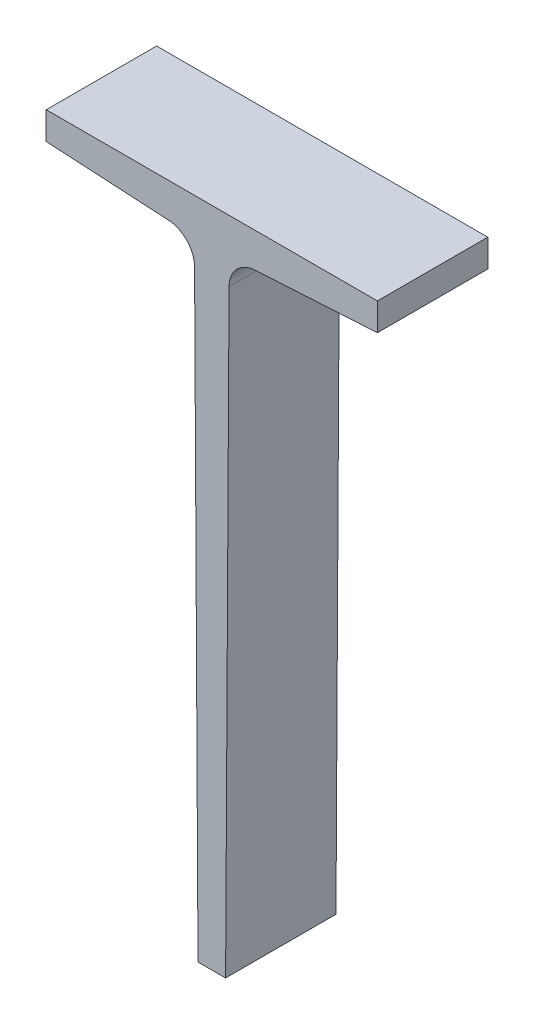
SolidWorks part; units mm, degrees
ref_plane "Plane1" through (0, 0, 0) normal (0, 0, 1) x (1, 0, 0)
ref_plane "Plane2" through (0, 0, 0) normal (0, 1, 0) x (-1, 0, 0)
ref_plane "Plane3" through (0, 0, 0) normal (1, 0, 0) x (0, 0, -1)
other "Configuration Table"
sketch "Sketch1" plane through (0, 0, 0) normal (0, 0, 1) x (1, 0, 0)
  line L0 (0, 0) -> (76.2, 0)
  line L1 (15.6984, 0) -> (-15.6984, 0) construction
  line L2 (34.925, -152.4) -> (34.1313, -14.2409)
  line L3 (28.139, -7.9375) -> (0, -6.35)
  line L4 (0, -9.8115) -> (0, 9.8115) construction
  line L5 (76.2, 0) -> (76.2, -6.35)
  line L6 (0, 0) -> (0, -6.35)
  line L7 (76.2, -6.35) -> (48.061, -7.9375)
  line L8 (42.0688, -14.2409) -> (41.275, -152.4)
  line L9 (34.925, -152.4) -> (41.275, -152.4)
  arc A1 (34.1313, -14.2409) -> (28.139, -7.9375) centre (27.7814, -14.2774) ccw
  arc A2 (48.061, -7.9375) -> (42.0688, -14.2409) centre (48.4186, -14.2774) ccw
  dimension "Radius_1" = 6.35
  dimension "H_Leg" = 76.2
  dimension "V_Leg" = 152.4
  dimension "t2" = 7.9375
extrude "Base-T" add sketch "Sketch1" along normal mid plane 25.4
